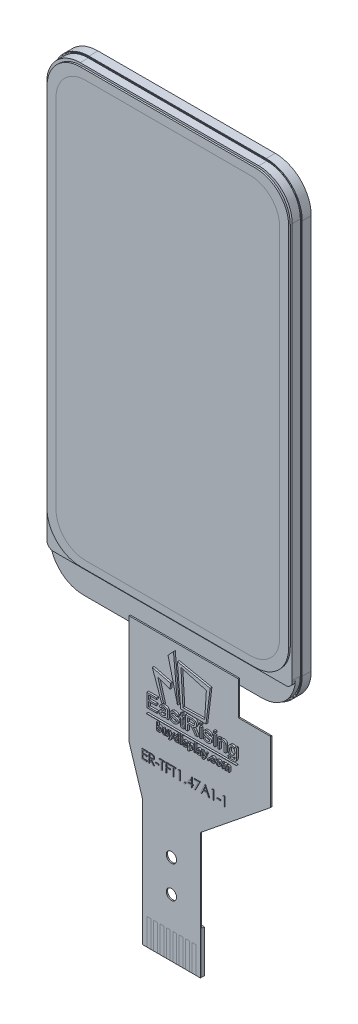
SolidWorks part; units mm, degrees
ref_plane "Front Plane" through (0, 0, 0) normal (0, 0, 1) x (1, 0, 0)
ref_plane "Top Plane" through (0, 0, 0) normal (0, 1, 0) x (1, 0, 0)
ref_plane "Right Plane" through (0, 0, 0) normal (1, 0, 0) x (0, 0, -1)
imported_body "ER-TFT1.47A1-1.STEP<1>"
delete or keep bodies "Body-Delete/Keep 1" type delete bodies bodies 101
delete or keep bodies "Body-Delete/Keep 2" type delete bodies bodies 120 119 118 117 116 115 114 113
delete or keep bodies "Body-Delete/Keep 3" type delete bodies bodies 111 110 109 108 107 106 105 104 103 102
delete or keep bodies "Body-Delete/Keep 4" type delete bodies bodies 112
delete or keep bodies "Body-Delete/Keep 5" type delete bodies bodies 147 146 145 144 143 142 141 140 139 138 137 136 135 134 133 132 131 130 129 128 127 126 125 124 123 122
